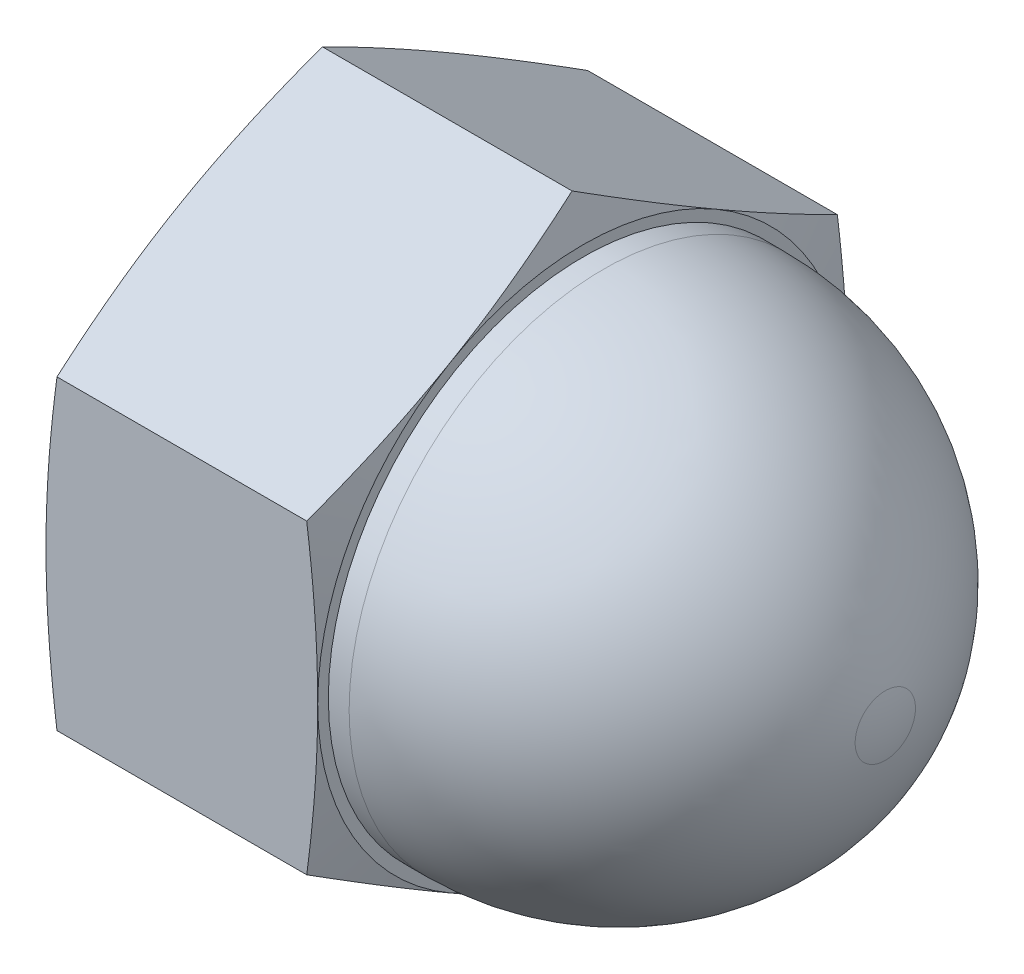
SolidWorks part; units mm, degrees
ref_plane "Plane1" through (0, 0, 0) normal (0, 0, 1) x (1, 0, 0)
ref_plane "Plane2" through (0, 0, 0) normal (0, 1, 0) x (1, 0, 0)
ref_plane "Plane3" through (0, 0, 0) normal (1, 0, 0) x (0, 0, -1)
sketch "BaseNutSke" plane through (0, 0, 0) normal (1, 0, 0) x (0, 0, -1)
  line L6 (3.9688, 2.2914) -> (3.9688, -2.2914)
  line L7 (-3.9688, 2.2914) -> (-3.9688, -2.2914)
  line L8 (3.9688, 2.2914) -> (0, 4.5827)
  line L9 (0, 4.5827) -> (-3.9688, 2.2914)
  line L10 (-3.9688, -2.2914) -> (0, -4.5827)
  line L11 (0, -4.5827) -> (3.9688, -2.2914)
  dimension "D4" = 60
  dimension "D1" = 120
  dimension "D2" = 3.9688
  dimension "D3" = 3.9688
  dimension "Width_flats" = 7.9375
extrude "BaseNut" add sketch "BaseNutSke" along normal blind 4.064
sketch "Sketch3" plane through (0, 0, 0) normal (0, 0, 1) x (1, 0, 0)
  line L0 (0, 0) -> (63.5, 0) construction
  line L1 (0, 2.2914) -> (0, -2.2914) construction
  line L2 (8.636, 0) -> (0, 0)
  line L3 (0, 3.81) -> (4.3752, 3.81)
  line L4 (0, -3.81) -> (22.225, -3.81) construction
  line L5 (0, 3.81) -> (0, 0)
  arc A0 (8.636, 0) -> (8.5852, 0.4516) centre (6.604, 0) ccw
  arc A1 (8.5852, 0.4516) -> (4.3752, 3.81) centre (4.3752, -0.508) ccw
  dimension "Nose_radius" = 2.032
  dimension "Body_radius" = 4.318
  dimension "Overall_ht" = 8.636
  dimension "Body_dia" = 7.62
revolve "Crown" add sketch "Sketch3" angle 360 about L0
sketch "Sketch4" plane through (0, 0, 0) normal (0, 0, 1) x (1, 0, 0)
  line L0 (0, 3.9688) -> (1.3632, 9.0562)
  line L1 (4.064, 3.9688) -> (2.7011, 9.0562)
  line L2 (1.3632, 9.0562) -> (2.7011, 9.0562)
  line L3 (4.064, 3.9688) -> (16.764, 3.9688)
  line L4 (16.764, 3.9688) -> (16.764, 29.3687)
  line L5 (16.764, 29.3687) -> (-12.7, 29.3687)
  line L6 (0, 3.9688) -> (-12.7, 3.9687)
  line L7 (-12.7, 3.9687) -> (-12.7, 29.3687)
  line L8 (4.064, 4.5827) -> (4.064, 2.2914) construction
  line L9 (0, 4.5827) -> (0, 2.2914) construction
  line L10 (0, 0) -> (57.15, 0) construction
  line L11 (4.064, 4.5827) -> (0, 4.5827) construction
  point P17 (4.064, 3.9688)
  dimension "D1" = 14.997
  dimension "D2" = 15
  dimension "D3" = 12.7
  dimension "D4" = 12.7
  dimension "D5" = 4.4735
  dimension "D6" = 25.4
  dimension "D7" = 3.9688
revolve "DoubleChamfer" cut sketch "Sketch4" angle 360 about L10
sketch "Sketch5" plane through (0, 0, 0) normal (0, 0, 1) x (1, 0, 0)
  line L0 (0, 0) -> (44.45, 0) construction
  line L1 (0, 1.7272) -> (6.35, 1.7272)
  line L2 (0, 0) -> (0, -3.437) construction
  line L3 (6.35, 1.7272) -> (7.3878, 0)
  line L4 (0, 0) -> (63.5, 0) construction
  line L5 (7.3878, 0) -> (0, 0)
  line L6 (0, 0) -> (0, 1.7272)
  line L7 (6.35, -1.7272) -> (7.3878, 0) construction
  line L8 (0, -1.7272) -> (6.35, -1.7272) construction
  dimension "TPA" = 118
  dimension "Thread_min" = 3.4544
  dimension "Drill_depth" = 6.35
revolve "TapDrill" cut sketch "Sketch5"
pattern_linear "ThdSchPat" [suppressed]
revolve "ThreadSchematic" cut sketch "ThdSchSke" angle 360 about L0
sketch "ThdSchSke" plane through (0, 0, 0) normal (0, 1, 0) x (1, 0, 0)
  line L0 (0.0381, 2.0828) -> (-0.2109, 1.7272)
  line L1 (-0.2109, 1.7272) -> (-0.2109, 0.8636)
  line L2 (-0.2109, 0.8636) -> (0.2871, 0.8636)
  line L3 (0.2871, 0.8636) -> (0.2871, 1.7272)
  line L4 (0.2871, 1.7272) -> (0.0381, 2.0828)
  line L5 (-38.1, 0) -> (3.175, 0) construction
  line L6 (0, 0) -> (-15.875, 0) construction
  line L7 (0, 0) -> (63.5, 0) construction
  line L9 (0.8306, -7.4422) -> (0.8306, -13.7922) construction
  dimension "D1" = 360
  dimension "VeeAngle" = 70
  dimension "SideAngle" = 55
  dimension "Thread_major" = 4.1656
  dimension "Tap_drill" = 3.4544
  dimension "OverCut" = 1.7272
  dimension "D2" = 1
  dimension "Advance" = 0.6689
  dimension "Num_threads" = 7
  dimension "D4" = 50
  dimension "Thread_depth" = 4.064
  dimension "Thread_nominal" = 4.1656
sketch "EndChamferSketch" plane through (0, 0, 0) normal (0, 0, 1) x (1, 0, 0)
  line L0 (-0.0254, 2.0828) -> (0.0254, 2.0828)
  line L1 (0.0254, 2.0828) -> (0.2993, 1.6916)
  line L2 (0.2993, 1.6916) -> (-0.0254, 1.6916)
  line L3 (-0.0254, 1.6916) -> (-0.0254, 2.0828)
  line L4 (0, 0) -> (-15.875, 0) construction
  dimension "D1" = 0.0508
  dimension "D2" = 35
  dimension "D3" = 0.0254
  dimension "ChamferDepth" = 0.3912
  dimension "ThreadMajor" = 2.0828
revolve "EndChamfer" cut sketch "EndChamferSketch" angle 360 about L4
equation "\"D2@BaseNutSke\" = \"Width_flats@BaseNutSke\" / 2"
equation "\"D3@BaseNutSke\" = \"Width_flats@BaseNutSke\" / 2"
equation "\"D7@Sketch4\" = \"Width_flats@BaseNutSke\" / 2"
equation "\"Thread_major@ThdSchSke\" = \"Thread_nominal@ThreadCosmetic\""
equation "\"Tap_drill@ThdSchSke\" = \"Thread_min@Sketch5\""
equation "\"Overcut@ThdSchSke\" = \"Tap_drill@ThdSchSke\" * 0.5"
equation "\"Num_threads@ThdSchPat\" = int(  ( \"Hex_ht@BaseNut\" - 0.002 ) / \"Advance@ThdSchSke\" + 0.999 )  + 1"
equation "\"Advance@ThdSchPat\" = ( \"Hex_ht@BaseNut\" - 0.002 ) /  (\"Num_threads@ThdSchPat\" - 1) 'relax it"
equation "' \"Num_threads@ThdSchPat\" = \"Num_threads@ThdSchPat\" - sgn( \"Num_threads@ThdSchPat\" - 1) '---chamfered tips only---"
equation "\"ThreadMajor@EndChamferSketch\" = \"Thread_nominal@ThreadCosmetic\" * 0.5"
equation "\"ChamferDepth@EndChamferSketch\" = (\"Thread_nominal@ThreadCosmetic\" - \"Thread_min@Sketch5\") * 0.55"
